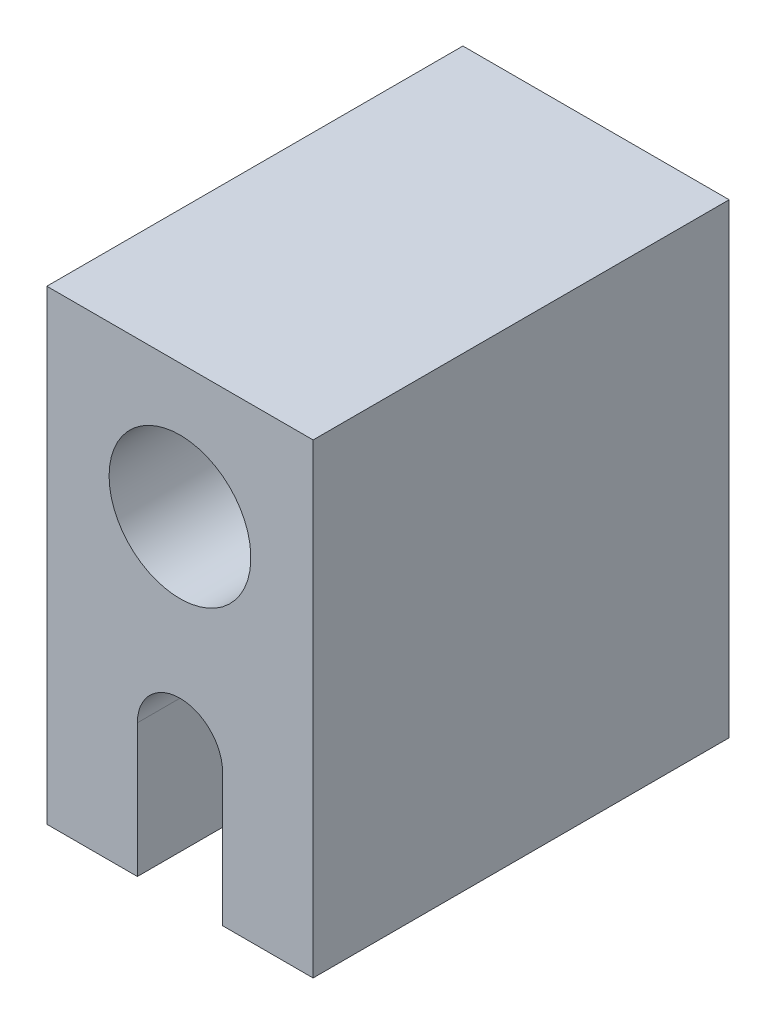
SolidWorks part; units mm, degrees
ref_plane "Front" through (0, 0, 0) normal (0, 0, 1) x (1, 0, 0)
ref_plane "Top" through (0, 0, 0) normal (0, 1, 0) x (1, 0, 0)
ref_plane "Right" through (0, 0, 0) normal (1, 0, 0) x (0, 0, -1)
sketch "Sketch1" plane through (0, 0, 0) normal (0, 0, 1) x (1, 0, 0)
  line L0 (-0.8128, 0) -> (-0.8128, 2.54)
  line L1 (-2.54, 0) -> (-0.8128, 0)
  line L2 (-2.54, 0) -> (-2.54, 8.89)
  line L3 (-2.54, 8.89) -> (2.54, 8.89)
  line L4 (2.54, 0) -> (2.54, 8.89)
  line L5 (0.8128, 2.54) -> (0.8128, 0)
  line L6 (0, 0) -> (0, 8.89) construction
  line L7 (0.8128, 0) -> (2.54, 0)
  arc A0 (-0.8128, 2.54) -> (0.8128, 2.54) centre (0, 2.54) cw
  dimension "D3" = 0.8128
  dimension "D1" = 5.08
  dimension "D2" = 8.89
  dimension "D4" = 2.54
extrude "Extrude1" add sketch "Sketch1" along normal blind 7.9375
hole_wizard "#6-32 Tapped Hole1" positions "Sketch4" profile "Sketch3" tap size "#6-32" standard "Ansi Inch"
sketch "Sketch4" plane through (0, 0, 0) normal (0, 0, -1) x (-1, 0, 0)
  line L0 (0, 8.89) -> (0, 5.7531) construction
  line L1 (-2.54, 8.89) -> (2.54, 8.89) construction
  point P0 (0, 6.35)
  dimension "D1" = 6.35
sketch "Sketch3" plane through (0, 6.35, 0) normal (1, 0, 0) x (0, 1, 0)
  line L0 (0, 0) -> (0, 7.9375)
  line L1 (0, 7.9375) -> (1.3525, 7.9375)
  line L2 (1.3525, 7.9375) -> (1.3525, 0)
  line L5 (1.3525, 0) -> (0, 0)
  line L11 (0, -6.35) -> (0, 107.95) construction
  dimension "Thru Tap Drill Dia." = 2.7051
  dimension "Thru Tap Drill Depth" = 7.9375
